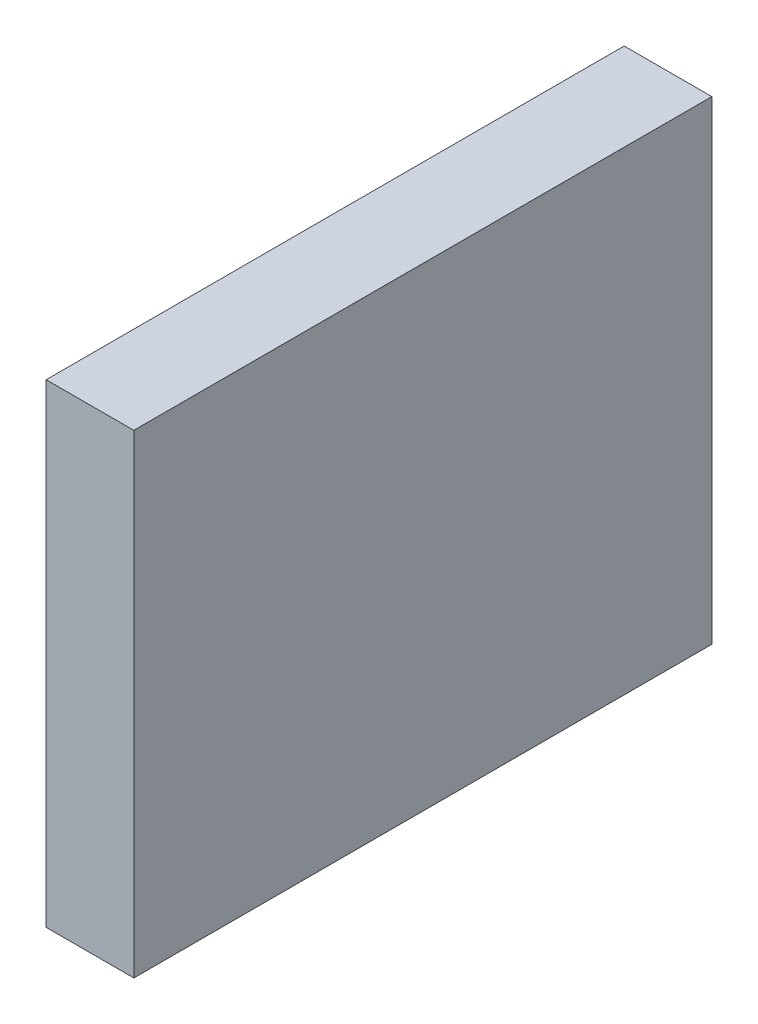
SolidWorks part; units mm, degrees
ref_plane "Ebene vorne" through (0, 0, 0) normal (0, 0, 1) x (1, 0, 0)
ref_plane "Ebene oben" through (0, 0, 0) normal (0, 1, 0) x (1, 0, 0)
ref_plane "Ebene rechts" through (0, 0, 0) normal (1, 0, 0) x (0, 0, -1)
sketch "Skizze1" plane through (0, 0, 0) normal (0, 0, 1) x (1, 0, 0)
  line L1 (0, 0) -> (15.4694, 0)
  line L2 (0, 0) -> (0, 83.7001)
  line L3 (0, 83.7001) -> (15.4694, 83.7001)
  line L4 (15.4694, 0) -> (15.4694, 83.7001)
extrude "Linear austragen1" add sketch "Skizze1" along normal blind 102
equation "\"LÄNGE\"=0"
equation "\"BREITE\"=0"
equation "\"HÖHE\"=0"
equation "\"DURCHMESSER\"=0"
equation "\"Stückzahl\"= 1"
